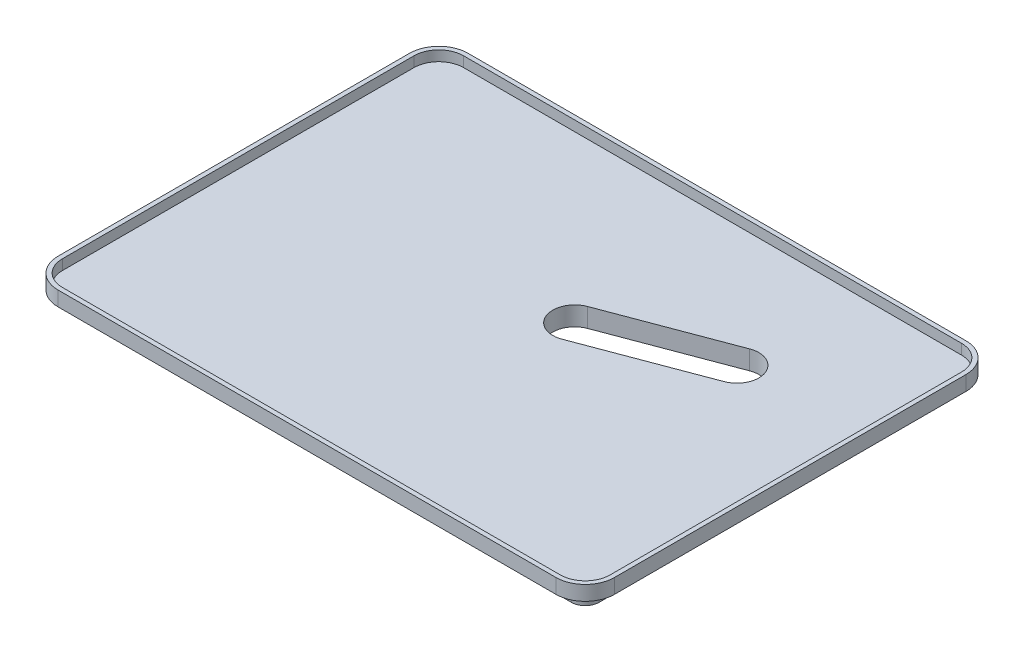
SolidWorks part; units mm, degrees
ref_plane "Plan de face" through (0, 0, 0) normal (0, 0, 1) x (1, 0, 0)
ref_plane "Plan de dessus" through (0, 0, 0) normal (0, 1, 0) x (1, 0, 0)
ref_plane "Plan de droite" through (0, 0, 0) normal (1, 0, 0) x (0, 0, -1)
sketch "Esquisse1" plane through (0, 0, 0) normal (0, 1, 0) x (1, 0, 0)
  line L1 (10, 0) -> (350, 0)
  line L2 (0, 10) -> (0, 250)
  line L3 (10, 260) -> (350, 260)
  line L4 (360, 10) -> (360, 250)
  arc A0 (360, 10) -> (350, 0) centre (350, 10) cw
  arc A1 (360, 250) -> (350, 260) centre (350, 250) ccw
  arc A2 (0, 250) -> (10, 260) centre (10, 250) cw
  arc A3 (10, 0) -> (0, 10) centre (10, 10) cw
  point P7 (360, 0)
  point P12 (0, 260)
  point P15 (0, 0)
  dimension "D3" = 10
  dimension "D4" = 10
  dimension "D1" = 360
  dimension "D2" = 260
extrude "Extrusion1" add sketch "Esquisse1" against normal blind 10 draft 3
ref_plane "Plan1" through (0, 0, -130) normal (0, 0, 1) x (1, 0, 0)
ref_plane "Plan2" through (180, 0, 0) normal (1, 0, 0) x (0, 0, -1)
sketch "Esquisse3" plane through (0, 0, 0) normal (0, 1, 0) x (-1, 0, 0)
  line L8 (-370, -10) -> (-370, -250)
  line L9 (-350, -270) -> (-10, -270)
  line L10 (10, -250) -> (10, -10)
  line L11 (-10, 10) -> (-350, 10)
  line L12 (-370, -10) -> (-370, -250)
  line L13 (-350, -270) -> (-10, -270)
  line L14 (10, -250) -> (10, -10)
  line L15 (-10, 10) -> (-350, 10)
  arc A8 (-350, 10) -> (-370, -10) centre (-350, -10) ccw
  arc A9 (-370, -250) -> (-350, -270) centre (-350, -250) ccw
  arc A10 (-10, -270) -> (10, -250) centre (-10, -250) ccw
  arc A11 (10, -10) -> (-10, 10) centre (-10, -10) ccw
  arc A12 (-350, 10) -> (-370, -10) centre (-350, -10) ccw
  arc A13 (-370, -250) -> (-350, -270) centre (-350, -250) ccw
  arc A14 (-10, -270) -> (10, -250) centre (-10, -250) ccw
  arc A15 (10, -10) -> (-10, 10) centre (-10, -10) ccw
  dimension "D1" = 10
extrude "Extrusion2" add sketch "Esquisse3" along normal blind 10
sketch "Esquisse4" plane through (0, 10, 0) normal (0, 1, 0) x (-1, 0, 0)
  line L8 (-367, -10) -> (-367, -250)
  line L9 (-350, -267) -> (-10, -267)
  line L10 (7, -250) -> (7, -10)
  line L11 (-10, 7) -> (-350, 7)
  line L12 (-367, -10) -> (-367, -250)
  line L13 (-350, -267) -> (-10, -267)
  line L14 (7, -250) -> (7, -10)
  line L15 (-10, 7) -> (-350, 7)
  arc A8 (-350, 7) -> (-367, -10) centre (-350, -10) ccw
  arc A9 (-367, -250) -> (-350, -267) centre (-350, -250) ccw
  arc A10 (-10, -267) -> (7, -250) centre (-10, -250) ccw
  arc A11 (7, -10) -> (-10, 7) centre (-10, -10) ccw
  arc A12 (-350, 7) -> (-367, -10) centre (-350, -10) ccw
  arc A13 (-367, -250) -> (-350, -267) centre (-350, -250) ccw
  arc A14 (-10, -267) -> (7, -250) centre (-10, -250) ccw
  arc A15 (7, -10) -> (-10, 7) centre (-10, -10) ccw
  dimension "D1" = 3
extrude "Enlèv. mat.-Extru.1" cut sketch "Esquisse4" against normal blind 7
sketch "Esquisse5" plane through (0, -10, 0) normal (0, -1, 0) x (1, 0, 0)
  line L0 (284.58, -170.2597) -> (204.0854, -139.984)
  line L1 (274.0188, -198.3392) -> (193.5241, -168.0635)
  arc A2 (284.58, -170.2597) -> (274.0188, -198.3392) centre (279.2994, -184.2994) cw
  arc A3 (204.0854, -139.984) -> (193.5241, -168.0635) centre (198.8048, -154.0238) ccw
extrude "Enlèv. mat.-Extru.2" cut sketch "Esquisse5" against normal through all
